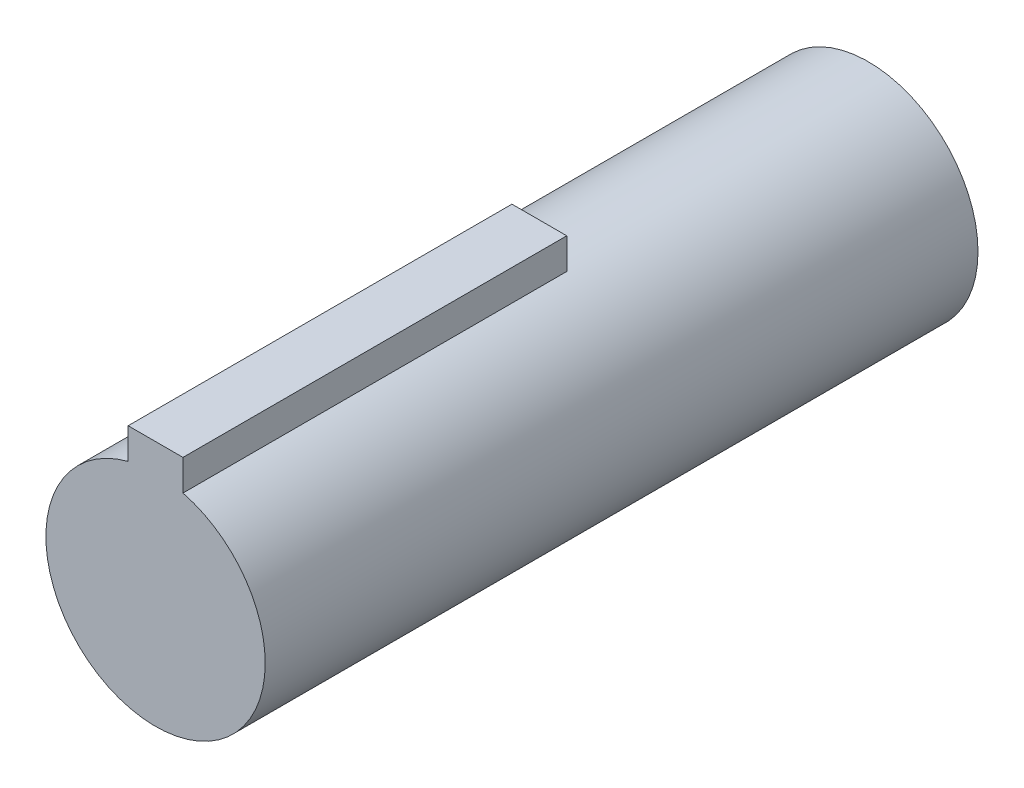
SolidWorks part; units mm, degrees
ref_plane "Front" through (0, 0, 0) normal (0, 0, 1) x (1, 0, 0)
ref_plane "Top" through (0, 0, 0) normal (0, 1, 0) x (1, 0, 0)
ref_plane "Right" through (0, 0, 0) normal (1, 0, 0) x (0, 0, -1)
sketch "Sketch1" plane through (0, 0, 0) normal (0, 0, 1) x (1, 0, 0)
  line L3 (-5, 25) -> (-5, 19.3649)
  line L4 (5, 25) -> (-5, 25)
  line L5 (5, 19.3649) -> (5, 25)
  arc A1 (-5, 19.3649) -> (5, 19.3649) centre (0, 0) ccw
extrude "Extrude1" add sketch "Sketch1" against normal blind 120 and the other way blind 10
sketch "Sketch2" plane through (0, 0, -120) normal (0, 0, -1) x (-1, 0, 0)
  line L3 (5, 25) -> (-5, 25)
  line L4 (-5, 25) -> (-5, 19.3649)
  line L5 (5, 19.3649) -> (5, 25)
  line L6 (5, 25) -> (-5, 25)
  line L7 (-5, 25) -> (-5, 19.3649)
  line L8 (5, 19.3649) -> (5, 25)
  arc A0 (5, 19.3649) -> (-5, 19.3649) centre (0, 0) ccw
  arc A1 (-5, 19.3649) -> (5, 19.3649) centre (0, 0) ccw
  dimension "D1" = 0
extrude "Cut-Extrude1" cut sketch "Sketch2" against normal blind 60
